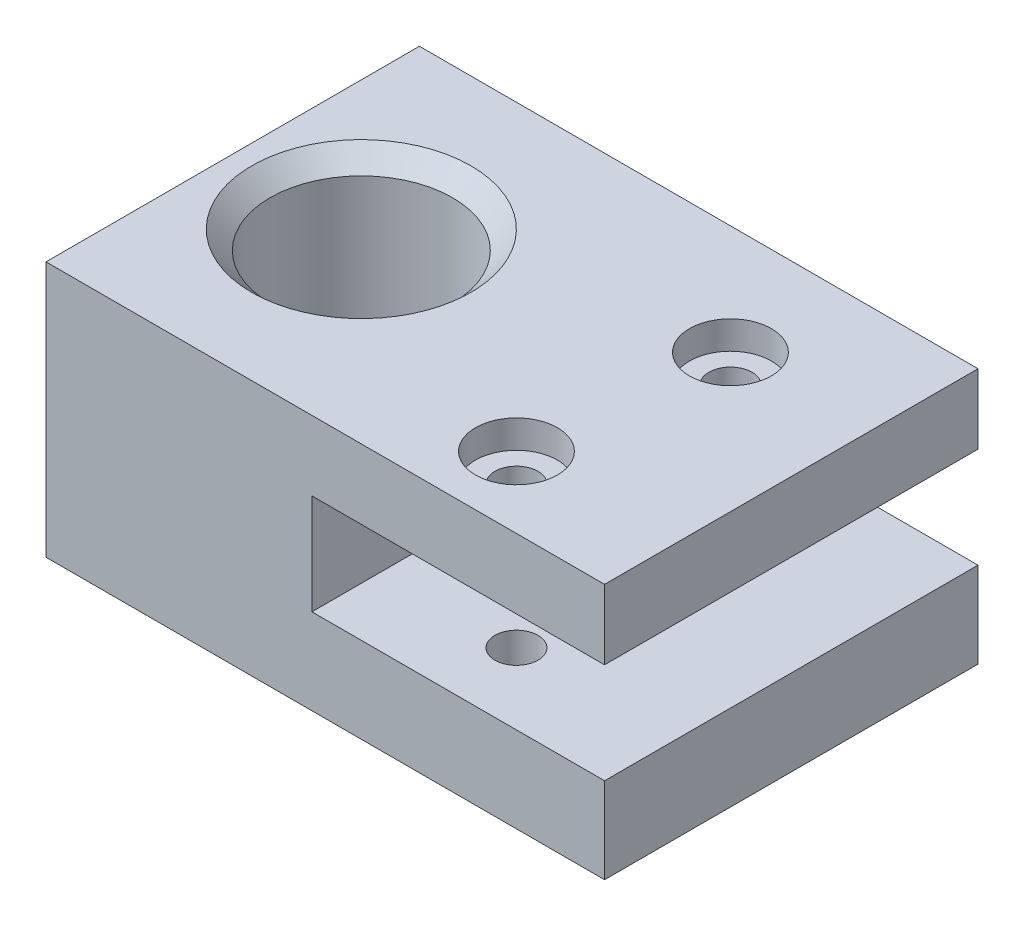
SolidWorks part; units mm, degrees
ref_plane "Front Plane" through (0, 0, 0) normal (0, 0, 1) x (1, 0, 0)
ref_plane "Top Plane" through (0, 0, 0) normal (0, 1, 0) x (1, 0, 0)
ref_plane "Right Plane" through (0, 0, 0) normal (1, 0, 0) x (0, 0, -1)
sketch "Sketch1" plane through (0, 0, 0) normal (0, 1, 0) x (1, 0, 0)
  line L1 (-63.6576, 44.2683) -> (90.5104, 44.2683)
  line L2 (-63.6576, 44.2683) -> (-63.6576, -58.8041)
  line L3 (-63.6576, -58.8041) -> (90.5104, -58.8041)
  line L4 (90.5104, 44.2683) -> (90.5104, -58.8041)
extrude "Extrude1" add sketch "Sketch1" along normal blind 70.612
sketch "Sketch2" plane through (0, 0, 58.8041) normal (0, 0, 1) x (1, 0, 0)
  line L1 (93.7683, 51.3744) -> (9.741, 51.3744)
  line L2 (93.7683, 51.3744) -> (93.7683, 23.6601)
  line L3 (93.7683, 23.6601) -> (9.741, 23.6601)
  line L4 (9.741, 51.3744) -> (9.741, 23.6601)
extrude "Cut-Extrude1" cut sketch "Sketch2" against normal through all
sketch "Sketch3" plane through (0, 70.612, 0) normal (0, 1, 0) x (-1, 0, 0)
  circle A0 centre (27.9716, 7.4587) radius 25.1822
extrude "Cut-Extrude2" cut sketch "Sketch3" against normal through all
chamfer "Chamfer1" distance 5.08 angle 45 1 edges at (-27.9716, 70.612, 32.6409)
hole_wizard "CBORE for 7/16 Pan Head Machine Screw1" positions "Sketch9" profile "Sketch8" counterbore size "7/16" standard "Ansi Inch"
sketch "Sketch9" plane through (0, 70.612, 0) normal (0, 1, 0) x (-1, 0, 0)
  line L0 (-90.5104, 58.8041) -> (-90.5104, -44.2683) construction
  point P0 (-52.4104, -14.0407)
  point P1 (-46.5618, 39.1739)
  dimension "D1" = 38.1
sketch "Sketch8" plane through (52.4104, 70.612, -14.0407) normal (1, 0, 0) x (0, 0, 1)
  line L0 (0, 0) -> (0, 70.612)
  line L1 (0, 70.612) -> (5.9525, 70.612)
  line L3 (5.9525, 70.612) -> (5.9525, 7.747)
  line L4 (5.9525, 7.747) -> (11.3106, 7.747)
  line L5 (11.3106, 7.747) -> (11.3106, 0)
  line L7 (11.3106, 0) -> (0, 0)
  line L11 (0, -6.35) -> (0, 107.95) construction
  dimension "Thru Hole Dia." = 11.905
  dimension "Thru Hole Depth" = 70.612
  dimension "C'Bore Dia." = 22.6212
  dimension "C'Bore Depth" = 7.747
